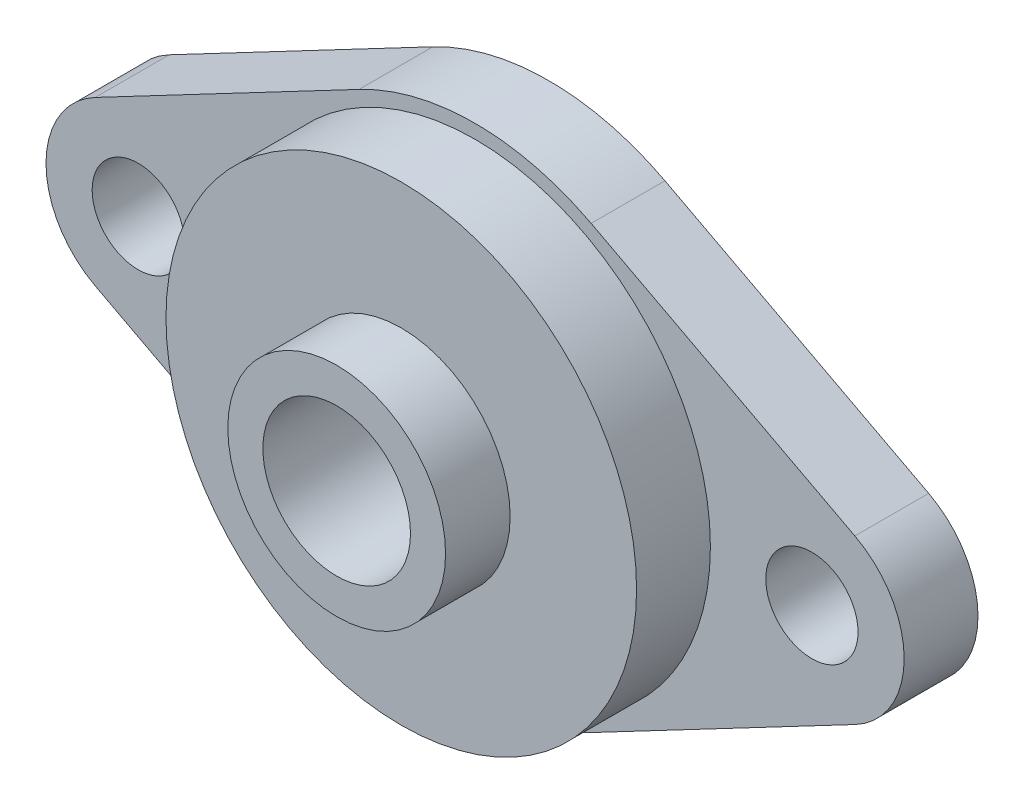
SolidWorks part; units mm, degrees
ref_plane "Plan de face" through (0, 0, 0) normal (0, 0, 1) x (1, 0, 0)
ref_plane "Plan de dessus" through (0, 0, 0) normal (0, 1, 0) x (1, 0, 0)
ref_plane "Plan de droite" through (0, 0, 0) normal (1, 0, 0) x (0, 0, -1)
sketch "Esquisse1" plane through (0, 0, 0) normal (0, 0, 1) x (1, 0, 0)
  line L0 (0, 0) -> (18.25, 0) construction
  line L1 (0, 0) -> (0, 15.7283) construction
  line L2 (6.2877, 11.9463) -> (20.5788, 4.4246)
  line L3 (6.2877, -11.9463) -> (20.5788, -4.4246)
  line L4 (-6.2877, -11.9463) -> (-20.5788, -4.4246)
  line L5 (-6.2877, 11.9463) -> (-20.5788, 4.4246)
  circle A0 centre (0, 0) radius 4
  arc A1 (6.2877, 11.9463) -> (-6.2877, 11.9463) centre (0, 0) ccw
  arc A2 (20.5788, -4.4246) -> (20.5788, 4.4246) centre (18.25, 0) ccw
  arc A3 (-20.5788, -4.4246) -> (-20.5788, 4.4246) centre (-18.25, 0) cw
  arc A4 (-6.2877, -11.9463) -> (6.2877, -11.9463) centre (0, 0) ccw
  circle A5 centre (18.25, 0) radius 2.5
  circle A6 centre (-18.25, 0) radius 2.5
  dimension "D1" = 13.5
  dimension "D2" = 5
  dimension "D3" = 5
  dimension "D4" = 8
  dimension "D5" = 36.5
extrude "Boss.-Extru.1" add sketch "Esquisse1" along normal blind 4
sketch "Esquisse2" plane through (0, 0, 4) normal (0, 0, 1) x (1, 0, 0)
  circle A0 centre (0, 0) radius 12.75
  circle A1 centre (0, 0) radius 4 construction
  circle A2 centre (0, 0) radius 4
  dimension "D1" = 25.5
extrude "Boss.-Extru.2" add sketch "Esquisse2" along normal blind 4
sketch "Esquisse3" plane through (0, 0, 8) normal (0, 0, 1) x (1, 0, 0)
  circle A0 centre (0, 0) radius 5.9
  circle A1 centre (0, 0) radius 4 construction
  circle A2 centre (0, 0) radius 4
  dimension "D1" = 11.8
extrude "Boss.-Extru.3" add sketch "Esquisse3" along normal blind 3.5
